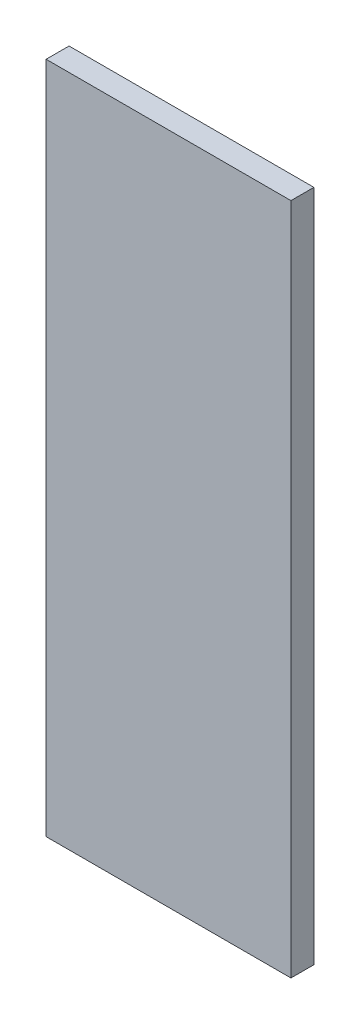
SolidWorks part; units mm, degrees
ref_plane "前基準面" through (0, 0, 0) normal (0, 0, 1) x (1, 0, 0)
ref_plane "上基準面" through (0, 0, 0) normal (0, 1, 0) x (1, 0, 0)
ref_plane "右基準面" through (0, 0, 0) normal (1, 0, 0) x (0, 0, -1)
imported_body "輸入1"
other "移動面1" parameters "D1"=0.5
